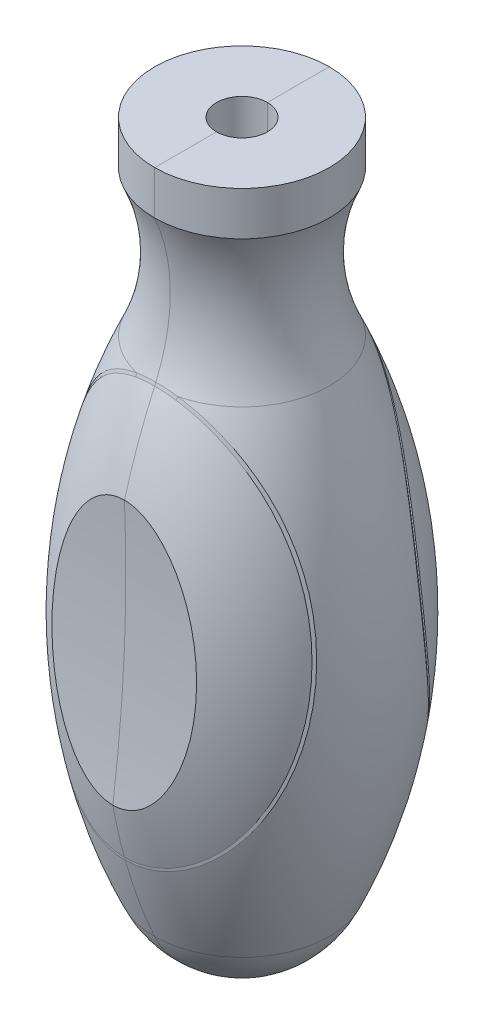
SolidWorks part; units mm, degrees
ref_plane "Front Plane" through (0, 0, 0) normal (0, 0, 1) x (1, 0, 0)
ref_plane "Top Plane" through (0, 0, 0) normal (0, 1, 0) x (1, 0, 0)
ref_plane "Right Plane" through (0, 0, 0) normal (1, 0, 0) x (0, 0, -1)
sketch "BBox" plane through (0, 0, 0) normal (1, 0, 0) x (0, 0, -1)
  line L4 (0, 0) -> (0, 220) construction
  line L5 (0, 100) -> (12, 100) construction
  line L6 (12, 100) -> (12, 0)
  line L7 (12, 0) -> (0, 0)
  line L8 (0, 220) -> (3.5, 220)
  line L9 (3.5, 220) -> (3.5, 100)
  dimension "D1" = 220
  dimension "D2" = 100
  dimension "D3" = 12
  dimension "D4" = 3.5
sketch "Handle" plane through (0, 0, 0) normal (1, 0, 0) x (0, 0, -1)
  line L4 (12, 100) -> (12, 94)
  line L5 (12, 100) -> (12, 0) construction
  line L7 (12, 100) -> (0, 100)
  line L8 (0, 100) -> (0, 0)
  arc A0 (12, 94) -> (12, 74) centre (34.2313, 84) ccw
  arc A1 (12, 74) -> (12, 8.5) centre (-60.8075, 41.25) cw
  arc A2 (12, 8.5) -> (0, 0) centre (-1.2238, 14.4483) cw
  dimension "D1" = 8.5
  dimension "D2" = 14.5
  dimension "D3" = 6
  dimension "D4" = 20
sketch "Grips" plane through (0, 0, 0) normal (1, 0, 0) x (0, 0, -1)
  line L0 (12, 74) -> (32.9937, 74)
  line L1 (32.9937, 74) -> (32.9937, 20)
  line L2 (32.9937, 20) -> (16.1466, 20)
  line L3 (0, 0) -> (0, 99.8972) construction
  line L4 (-32.9937, 20) -> (-16.1466, 20)
  line L5 (-32.9937, 74) -> (-32.9937, 20)
  line L6 (-12, 74) -> (-32.9937, 74)
  arc A0 (12, 74) -> (16.1466, 20) centre (67.4577, 51.0993) ccw
  arc A1 (12, 8.5) -> (12, 74) centre (-60.8075, 41.25) ccw construction
  arc A3 (-12, 74) -> (-16.1466, 20) centre (-67.4577, 51.0993) cw
  dimension "D1" = 60
  dimension "D2" = 20
revolve "Revolve1" add sketch "Handle" angle 360 about L8
sketch "Sketch4" plane through (0, 0, 0) normal (1, 0, 0) x (0, 0, -1)
  line L1 (3.5, 192.1141) -> (3.5, 30)
  line L2 (3.5, 30) -> (0, 30)
  line L3 (0, 0) -> (0, 220) construction
  line L4 (0, 30) -> (0, 220)
  line L5 (3.6557, 193.8721) -> (5.8443, 206.1279)
  line L7 (6, 207.8859) -> (6, 220)
  line L9 (0, 220) -> (6, 220)
  arc A0 (5.8443, 206.1279) -> (6, 207.8859) centre (-4, 207.8859) ccw
  arc A1 (3.6557, 193.8721) -> (3.5, 192.1141) centre (13.5, 192.1141) ccw
  point P12 (6, 207)
  point P16 (3.5, 193)
  dimension "D2" = 6
  dimension "D5" = 10
  dimension "D1" = 30
  dimension "D3" = 13
  dimension "D4" = 14
revolve "Revolve2" add sketch "Sketch4" angle 360 about L4
sketch "Sketch5" plane through (0, 0, 0) normal (0, 0, 1) x (1, 0, 0)
  line L0 (3.5, 80) -> (7.5, 75)
  line L1 (3.5, 30) -> (3.5, 192.1141) construction
  line L2 (7.5, 75) -> (7.5, 65)
  line L3 (7.5, 65) -> (3.5, 60)
  line L4 (3.5, 60) -> (-3.5, 60)
  line L5 (0, 0) -> (0, 220) construction
  line L6 (0, 60) -> (0, 80) construction
  line L7 (-3.5, 80) -> (3.5, 80)
  line L8 (-7.5, 65) -> (-3.5, 60)
  line L9 (-7.5, 75) -> (-7.5, 65)
  line L10 (-3.5, 80) -> (-7.5, 75)
  dimension "D1" = 7.5
  dimension "D2" = 60
  dimension "D3" = 20
  dimension "D4" = 10
extrude "Boss-Extrude2" add sketch "Sketch5" along normal mid plane 3
sketch "Sketch11" plane through (0, 0, 0) normal (1, 0, 0) x (0, 0, -1)
  line L0 (0.75, 220) -> (3.5, 187)
  line L1 (0, 220) -> (3.5, 220) construction
  line L2 (3.5, 220) -> (3.5, 100) construction
  line L3 (0.75, 220) -> (0, 220)
  line L4 (0, 220) -> (0, 230.4461) construction
  line L5 (0.75, 220) -> (10.893, 220)
  line L6 (10.893, 220) -> (10.893, 187)
  line L7 (10.893, 187) -> (3.5, 187)
  line L8 (-0.75, 220) -> (-10.893, 220)
  line L9 (-10.893, 220) -> (-10.893, 187)
  line L10 (-10.893, 187) -> (-3.5, 187)
  line L11 (-0.75, 220) -> (-3.5, 187)
  dimension "D1" = 33
  dimension "D2" = 0.75
extrude "Cut-Extrude4" cut sketch "Sketch11" against normal mid plane 20 contours L7 L6 L5 L0 | L11 L8 L9 L10
combine bodies "Combine1" operation type subtract main body 101 bodies to subtract 110
sketch "Sketch14" plane through (0, 0, 0) normal (1, 0, 0) x (0, 0, -1)
  line L0 (21.5489, 27) -> (20.6466, 27)
  line L1 (20.6466, 27) -> (20.6466, 62.5)
  line L2 (20.6466, 62.5) -> (16.1466, 62.5)
  line L3 (17.7466, 27) -> (20.6466, 27)
  arc A1 (12, 8.5) -> (12, 74) centre (-60.8075, 41.25) ccw construction
  arc A3 (16.1466, 62.5) -> (17.7466, 27) centre (215.9537, 53.7193) ccw
  dimension "D1" = 4.5
  dimension "D4" = 200
  dimension "D2" = 35.5
  dimension "D3" = 27
  dimension "D5" = 2.9
extrude "Cut-Extrude7" cut sketch "Sketch14" against normal through all both and the other way through all contours L1 L2 A3 L3
mirror "Mirror3" about plane through (0, 0, 0) normal (0, 0, 1) of "Cut-Extrude7"
split "Split1" trim tools "Grips" bodies to split 125 resulting bodies 112 113 114
sketch "Sketch13" plane through (0, 0, 0) normal (1, 0, 0) x (0, 0, -1)
  line L0 (0, 0) -> (0, 102.6432) construction
  line L1 (6.25, 60.8177) -> (12.5, 58.2682)
  line L2 (12.5, 58.2682) -> (12.5, 49.099)
  line L3 (12.5, 49.099) -> (6.25, 46.5495)
  line L4 (-12.5, 39) -> (-7.9779, 39)
  line L5 (12.5, 39) -> (15.0478, 32)
  line L6 (15.0478, 32) -> (9.3864, 26.7329)
  line L7 (0, 63.3672) -> (0, 44) construction
  line L8 (0, 39) -> (0, 18) construction
  line L9 (-15.0478, 32) -> (-9.3864, 26.7329)
  line L10 (-12.5, 39) -> (-15.0478, 32)
  line L11 (-12.5, 49.099) -> (-6.25, 46.5495)
  line L12 (-12.5, 58.2682) -> (-12.5, 49.099)
  line L13 (-6.25, 60.8177) -> (-12.5, 58.2682)
  line L14 (6.25, 58.6577) -> (10.5, 56.924)
  line L15 (10.5, 56.924) -> (10.5, 50.4432)
  line L16 (10.5, 50.4432) -> (6.25, 48.7095)
  line L17 (-10.5, 50.4432) -> (-6.25, 48.7095)
  line L18 (-10.5, 56.924) -> (-10.5, 50.4432)
  line L19 (-6.25, 58.6577) -> (-10.5, 56.924)
  line L20 (11.0996, 37) -> (12.7151, 32.5615)
  line L21 (12.7151, 32.5615) -> (9.103, 29.2009)
  line L22 (-12.7151, 32.5615) -> (-9.103, 29.2009)
  line L23 (-11.0996, 37) -> (-12.7151, 32.5615)
  line L24 (-11.0996, 37) -> (-8.2075, 37)
  line L25 (-6.25, 60.8177) -> (-6.25, 46.5495)
  line L26 (-7.9779, 39) -> (-9.3864, 26.7329)
  line L27 (7.9779, 39) -> (9.3864, 26.7329)
  line L28 (6.25, 60.8177) -> (6.25, 46.5495)
  line L29 (0, 63.3672) -> (-12.5, 58.2682) construction
  line L30 (0, 61.2072) -> (-10.5, 56.924) construction
  line L31 (0, 63.3672) -> (12.5, 58.2682) construction
  line L32 (0, 61.2072) -> (10.5, 56.924) construction
  line L33 (10.5, 50.4432) -> (0, 46.16) construction
  line L34 (12.5, 49.099) -> (0, 44) construction
  line L35 (-10.5, 50.4432) -> (0, 46.16) construction
  line L36 (-12.5, 49.099) -> (0, 44) construction
  line L37 (7.9779, 39) -> (12.5, 39)
  line L38 (-12.5, 39) -> (12.5, 39) construction
  line L39 (8.2075, 37) -> (11.0996, 37)
  line L40 (-11.0996, 37) -> (11.0996, 37) construction
  line L41 (-12.7151, 32.5615) -> (0, 20.7317) construction
  line L42 (-15.0478, 32) -> (0, 18) construction
  line L43 (12.7151, 32.5615) -> (0, 20.7317) construction
  line L44 (15.0478, 32) -> (0, 18) construction
  dimension "D1" = 12.5
  dimension "D2" = 12.5
  dimension "D3" = 18
  dimension "D4" = 44
  dimension "D5" = 19.3672
  dimension "D6" = 110
  dimension "D7" = 7
  dimension "D8" = 14
  dimension "D9" = 13.5
  dimension "D10" = 2
extrude "Boss-Extrude4" add sketch "Sketch13" along normal mid plane 3 draft 2 contours L25 L13 L12 L11 L17 L18 L19 | L26 L4 L10 L9 L22 L23 L24 | L27 L39 L20 L21 L6 L5 L37 | L1 L28 L14 L15 L16 L3 L2
chamfer "Chamfer1" distance 0.25 angle 45 2 edges at (-3.508, 20.4383, -15.8835) (-5.6725, 21.1743, 15.453)
